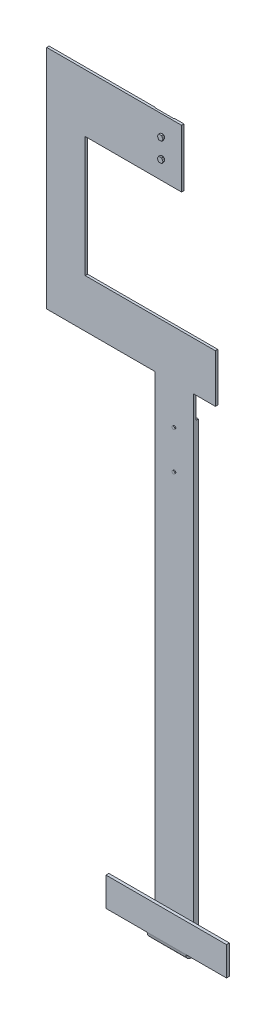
SolidWorks part; units mm, degrees
ref_plane "Front Plane" through (0, 0, 0) normal (0, 0, 1) x (1, 0, 0)
ref_plane "Top Plane" through (0, 0, 0) normal (0, 1, 0) x (1, 0, 0)
ref_plane "Right Plane" through (0, 0, 0) normal (1, 0, 0) x (0, 0, -1)
sketch "Schizzo1" plane through (0, 0, 0) normal (0, 0, 1) x (1, 0, 0)
  line L0 (49.621, 172.5315) -> (94.621, 172.5315)
  line L1 (-30.379, 172.5315) -> (-255.379, 172.5315)
  line L2 (-30.379, 172.5315) -> (-30.379, -27.4685)
  line L3 (-30.379, -27.4685) -> (49.621, -27.4685)
  line L4 (49.621, 172.5315) -> (49.621, -27.4685)
  line L6 (94.621, 172.5315) -> (49.621, 172.5315)
  line L7 (94.621, 172.5315) -> (94.621, 272.5315)
  line L8 (94.621, 272.5315) -> (-175.379, 272.5315)
  line L9 (-255.379, 172.5315) -> (-255.379, 272.5315)
  line L11 (-255.379, 272.5315) -> (-255.379, 522.5315)
  line L13 (-175.379, 272.5315) -> (-175.379, 522.5315)
  line L14 (-175.379, 522.5315) -> (24.621, 522.5315)
  line L15 (-255.379, 522.5315) -> (-255.379, 642.5315)
  line L16 (-255.379, 642.5315) -> (24.621, 642.5315)
  line L17 (24.621, 522.5315) -> (24.621, 642.5315)
  dimension "D1" = 80
  dimension "D2" = 200
  dimension "D3" = 45
  dimension "D4" = 100
  dimension "D5" = 350
  dimension "D6" = 80
  dimension "D8" = 280
  dimension "D9" = 120
extrude "Estrusione-Estrusione1" add sketch "Schizzo1" along normal blind 5 contours L14 L17 L16 L15 L11 L9 L1 L2 L3 L4 L0 L7 L8 L13
sketch "Schizzo2" plane through (0, 0, 0) normal (0, 0, -1) x (-1, 0, 0)
  line L0 (255.379, 642.5315) -> (-24.621, 642.5315) construction
  line L1 (-4.621, 642.5315) -> (35.379, 642.5315)
  line L2 (-4.621, 642.5315) -> (-4.621, 522.5315)
  line L3 (-4.621, 522.5315) -> (35.379, 522.5315)
  line L4 (35.379, 642.5315) -> (35.379, 522.5315)
  line L5 (175.379, 522.5315) -> (-24.621, 522.5315) construction
  line L6 (-24.621, 522.5315) -> (-24.621, 642.5315) construction
  point P8 (-24.621, 582.5315)
  dimension "D1" = 40
  dimension "D2" = 20
extrude "Taglio-Estrusione1" cut sketch "Schizzo2" against normal blind 1
sketch "Schizzo3" plane through (0, 0, 5) normal (0, 0, 1) x (1, 0, 0)
  line L0 (-255.379, 642.5315) -> (24.621, 642.5315) construction
  line L1 (24.621, 522.5315) -> (24.621, 642.5315) construction
  circle A0 centre (-15.379, 562.5315) radius 5
  circle A1 centre (-15.379, 602.5315) radius 5
  dimension "D1" = 10
  dimension "D3" = 10
  dimension "D2" = 40
  dimension "D4" = 40
  dimension "D5" = 40
extrude "Estrusione-Estrusione2" add sketch "Schizzo3" along normal blind 1.5 and the other way blind 8
sketch "Schizzo5" plane through (0, 0, 6.5) normal (0, 0, 1) x (1, 0, 0)
  line L0 (-26.3723, 602.5315) -> (-12.5313, 602.5315) construction
  line L1 (-15.379, 608.546) -> (-15.379, 596.6904) construction
  line L2 (-25.3376, 607.7892) -> (-15.4242, 607.7892) construction
  line L3 (-15.4242, 607.7892) -> (-15.4242, 597.2738) construction
  line L4 (-15.4242, 597.2738) -> (-25.3376, 597.2738) construction
  line L5 (-25.3376, 597.2738) -> (-25.3376, 607.7892) construction
  line L6 (-18.379, 607.7892) -> (-12.379, 607.7892)
  line L7 (-12.379, 607.7892) -> (-9.4883, 602.5315)
  line L8 (-9.4883, 602.5315) -> (-12.379, 597.2738)
  line L9 (-12.379, 597.2738) -> (-18.379, 597.2738)
  line L10 (-18.379, 597.2738) -> (-21.2698, 602.5315)
  line L11 (-21.2698, 602.5315) -> (-18.379, 607.7892)
  dimension "D1" = 6
  dimension "D2" = 6
  dimension "D3" = 6
  dimension "D4" = 6
  dimension "D5" = 6
  dimension "D6" = 6
  dimension "D7" = 3
extrude "Estrusione-Estrusione3" add sketch "Schizzo5" along normal blind 3
sketch "Schizzo6" plane through (0, 0, 6.5) normal (0, 0, 1) x (1, 0, 0)
  line L0 (-26.5129, 562.5315) -> (-12.3734, 562.5315) construction
  line L1 (-25.6646, 567.7) -> (-15.696, 567.7) construction
  line L2 (-15.696, 567.7) -> (-15.696, 557.3659) construction
  line L3 (-15.696, 557.3659) -> (-25.6646, 557.3659) construction
  line L4 (-25.6646, 557.3659) -> (-25.6646, 567.7) construction
  line L5 (-18.379, 567.7) -> (-12.379, 567.7)
  line L6 (-12.379, 567.7) -> (-9.3316, 562.5315)
  line L7 (-9.3316, 562.5315) -> (-12.3839, 557.3659)
  line L8 (-12.3839, 557.3659) -> (-18.3839, 557.3659)
  line L9 (-18.3839, 557.3659) -> (-21.4265, 562.5315)
  line L10 (-21.4265, 562.5315) -> (-18.379, 567.7)
  line L11 (-15.379, 570.2368) -> (-15.379, 556.6253) construction
  dimension "D1" = 6
  dimension "D2" = 3
  dimension "D3" = 6
  dimension "D4" = 6
  dimension "D5" = 6
  dimension "D6" = 5.9951
  dimension "D7" = 6
extrude "Estrusione-Estrusione4" add sketch "Schizzo6" along normal blind 3
sketch "Schizzo7" plane through (0, -27.4685, 0) normal (0, -1, 0) x (1, 0, 0)
  line L1 (-30.379, 5) -> (49.621, 5)
  line L2 (-30.379, 5) -> (-30.379, 0)
  line L3 (-30.379, 0) -> (49.621, 0)
  line L4 (49.621, 5) -> (49.621, 0)
extrude "Estrusione-Estrusione5" add sketch "Schizzo7" along normal blind 800
sketch "Schizzo8" plane through (0, 0, 5) normal (0, 0, 1) x (1, 0, 0)
  line L0 (-30.379, 172.5315) -> (-30.379, -827.4685) construction
  line L1 (-115.379, -765.9171) -> (134.621, -765.9171)
  line L2 (-115.379, -765.9171) -> (-115.379, -825.9171)
  line L3 (-115.379, -825.9171) -> (134.621, -825.9171)
  line L4 (134.621, -765.9171) -> (134.621, -825.9171)
  line L6 (-115.379, -806.5918) -> (121.7831, -806.5918) construction
  dimension "D1" = 250
  dimension "D2" = 85
  dimension "D3" = 60
extrude "Estrusione-Estrusione6" add sketch "Schizzo8" along normal blind 6 from offset 11 separate body
sketch "Schizzo10" plane through (0, -827.4685, 0) normal (0, -1, 0) x (1, 0, 0)
  line L0 (-33.4422, 10.6804) -> (53.5485, 10.6804) construction
  line L1 (-30.379, 5) -> (49.621, 5)
  line L2 (-30.379, 5) -> (-30.379, 0)
  line L3 (-30.379, 0) -> (49.621, 0)
  line L4 (49.621, 5) -> (49.621, 0)
revolve "Rivoluzione1" add sketch "Schizzo10" angle 180 about L0
sketch "Schizzo11" plane through (0, -827.4685, 0) normal (0, 1, 0) x (1, 0, 0)
  line L0 (-30.379, -16.3607) -> (-30.379, -21.3607) construction
  line L1 (49.621, -21.3607) -> (-30.379, -21.3607)
  line L2 (49.621, -21.3607) -> (49.621, -16.3607)
  line L3 (49.621, -16.3607) -> (-30.379, -16.3607)
  line L4 (-30.379, -21.3607) -> (-30.379, -16.3607)
extrude "Estrusione-Estrusione7" add sketch "Schizzo11" along normal blind 2
sketch "Schizzo12" plane through (0, 0, 5) normal (0, 0, 1) x (1, 0, 0)
  line L0 (-30.379, 172.5315) -> (-30.379, -827.4685) construction
  line L1 (49.621, -827.4685) -> (-30.379, -827.4685)
  line L2 (49.621, -827.4685) -> (49.621, 122.5315)
  line L3 (49.621, 122.5315) -> (-30.379, 122.5315)
  line L4 (-30.379, -827.4685) -> (-30.379, 122.5315)
  dimension "D1" = 950
extrude "Estrusione-Estrusione8" add sketch "Schizzo12" against normal blind 5 from offset 5
sketch "Schizzo13" plane through (0, 0, 5) normal (0, 0, 1) x (1, 0, 0)
  line L0 (49.621, 172.5315) -> (49.621, -827.4685) construction
  line L1 (-30.379, 172.5315) -> (49.621, 172.5315)
  line L2 (-30.379, 172.5315) -> (-30.379, -27.4685)
  line L3 (-30.379, -27.4685) -> (49.621, -27.4685)
  line L4 (49.621, 172.5315) -> (49.621, -27.4685)
  circle A0 centre (9.621, 12.5315) radius 3
  circle A1 centre (9.621, 92.5315) radius 3
  dimension "D2" = 6
  dimension "D3" = 6
  dimension "D1" = 200
  dimension "D4" = 40
  dimension "D5" = 80
  dimension "D6" = 40
extrude "Taglio-Estrusione2" cut sketch "Schizzo13" against normal blind 10 contours A1 | A0
sketch "Schizzo14" plane through (0, 0, 5) normal (0, 0, 1) x (1, 0, 0)
  circle A0 centre (9.621, 92.5315) radius 3
extrude "Estrusione-Estrusione9" add sketch "Schizzo14" along normal blind 2 and the other way blind 13
sketch "Schizzo16" plane through (0, 0, 5) normal (0, 0, 1) x (1, 0, 0)
  circle A0 centre (9.621, 12.5315) radius 3
  dimension "D1" = 6
extrude "Estrusione-Estrusione10" add sketch "Schizzo16" along normal blind 2 and the other way blind 13
